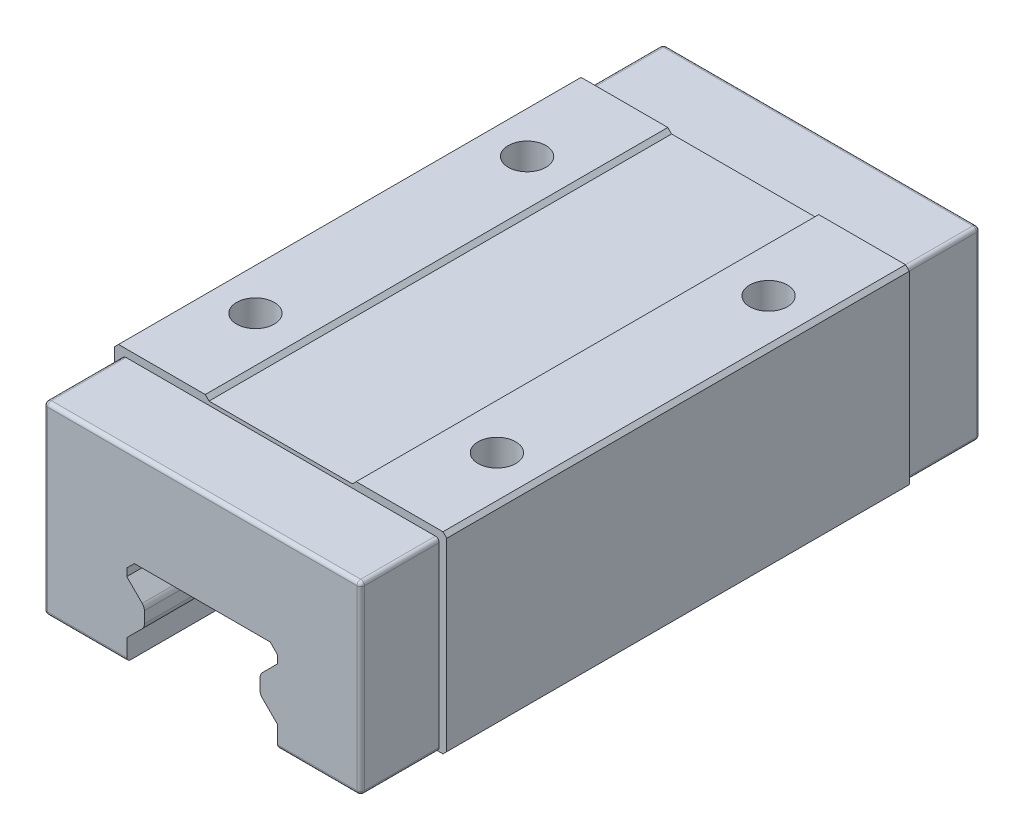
SolidWorks part; units mm, degrees
ref_plane "Front Plane" through (0, 0, 0) normal (0, 0, 1) x (1, 0, 0)
ref_plane "Top Plane" through (0, 0, 0) normal (0, 1, 0) x (1, 0, 0)
ref_plane "Right Plane" through (0, 0, 0) normal (1, 0, 0) x (0, 0, -1)
sketch "Sketch1" plane through (0, 0, 0) normal (0, 0, 1) x (1, 0, 0)
  line L1 (-22, 4.5) -> (22, 4.5)
  line L2 (-22, 4.5) -> (-22, 30)
  line L3 (-22, 30) -> (22, 30)
  line L4 (22, 4.5) -> (22, 30)
  line L5 (-22, 4.5) -> (22, 30) construction
  line L6 (-22, 30) -> (22, 4.5) construction
  point P0 (0, 17.25)
  dimension "D1" = 30
  dimension "D2" = 4.5
  dimension "D3" = 44
extrude "Boss-Extrude1" add sketch "Sketch1" along normal mid plane 61.3
sketch "Sketch2" plane through (0, 0, 0) normal (0, 0, 1) x (1, 0, 0)
  line L0 (-22, 4.5) -> (22, 4.5) construction
  line L1 (-21, 4.5) -> (21, 4.5)
  line L2 (-21, 4.5) -> (-21, 29)
  line L3 (-21, 29) -> (21, 29)
  line L4 (21, 4.5) -> (21, 29)
  line L5 (-21, 29) -> (-22, 29) construction
  line L6 (-22, 30) -> (-22, 4.5) construction
  line L7 (21, 29) -> (21, 30) construction
  line L8 (22, 30) -> (-22, 30) construction
  line L9 (21, 29) -> (22, 29) construction
  line L10 (22, 4.5) -> (22, 30) construction
  point P9 (0, 29)
  dimension "D1" = 1
extrude "Boss-Extrude2" add sketch "Sketch2" along normal mid plane 82.1
sketch "Sketch3" plane through (0, 0, 41.05) normal (0, 0, 1) x (1, 0, 0)
  line L1 (-10, 16.3) -> (10, 16.3)
  line L2 (-10, 16.3) -> (-10, 0)
  line L3 (-10, 0) -> (10, 0)
  line L4 (10, 16.3) -> (10, 0)
  line L5 (-10, 16.3) -> (10, 0) construction
  line L6 (-10, 0) -> (10, 16.3) construction
  point P0 (0, 8.15)
  dimension "D1" = 20
  dimension "D2" = 16.3
extrude "Cut-Extrude1" cut sketch "Sketch3" against normal through all
sketch "Sketch4" plane through (0, 0, 41.05) normal (0, 0, 1) x (1, 0, 0)
  line L0 (-10, 14.3) -> (-10, 7.3)
  line L1 (-10, 16.3) -> (-10, 4.5) construction
  line L2 (-10, 7.3) -> (-7.6667, 9.6333)
  line L3 (-7.6667, 9.6333) -> (-7.6667, 11.9667)
  line L4 (-7.6667, 11.9667) -> (-10, 14.3)
  line L5 (10, 16.3) -> (-10, 16.3) construction
  line L6 (-7.6667, 11.9667) -> (-10, 11.9667) construction
  line L7 (-7.6667, 9.6333) -> (-10, 9.6333) construction
  line L8 (-8.8333, 11.9667) -> (-8.8333, 9.6333) construction
  line L9 (0, 0) -> (0, 16.3) construction
  line L10 (8.8333, 11.9667) -> (8.8333, 9.6333) construction
  line L11 (7.6667, 9.6333) -> (10, 9.6333) construction
  line L12 (7.6667, 11.9667) -> (10, 11.9667) construction
  line L13 (7.6667, 11.9667) -> (10, 14.3)
  line L14 (7.6667, 9.6333) -> (7.6667, 11.9667)
  line L15 (10, 7.3) -> (7.6667, 9.6333)
  line L16 (10, 14.3) -> (10, 7.3)
extrude "Boss-Extrude3" add sketch "Sketch4" against normal up to surface (82.1 mm away)
chamfer "Chamfer1" distance 1 angle 45 2 edges at (10, 16.3, 0) (-10, 16.3, 0)
fillet "Fillet1" radius 1 4 edges at (7.6667, 9.6333, 0) (7.6667, 11.9667, 0) (-7.6667, 9.6333, 0) (-7.6667, 11.9667, 0)
sketch "Sketch5" plane through (0, 0, 30.65) normal (0, 0, 1) x (1, 0, 0)
  line L0 (22, 30) -> (-22, 30) construction
  line L1 (-10, 30) -> (10, 30)
  line L2 (-10, 30) -> (-10, 29.5)
  line L3 (-10, 29.5) -> (10, 29.5)
  line L4 (10, 30) -> (10, 29.5)
  point P6 (0, 29.5)
  dimension "D1" = 20
  dimension "D2" = 0.5
extrude "Cut-Extrude2" cut sketch "Sketch5" against normal through all
chamfer "Chamfer2" distance 0.5 angle 45 6 edges at (22, 30, 0) (22, 4.5, 0) (-22, 4.5, 0) (-22, 30, 0) (10, 29.5, 0) (-10, 29.5, 0)
fillet "Fillet2" radius 0.5 18 edges at (-21, 4.5, -35.85) (15.5, 4.5, -41.05) (-21, 4.5, 35.85) (-15.5, 4.5, -41.05) (-15.5, 4.5, 41.05) (15.5, 4.5, 41.05) (21, 4.5, 35.85) (-21, 16.75, 41.05) (-21, 16.75, -41.05) (-21, 29, 35.85) (21, 29, 35.85) (21, 16.75, 41.05) (21, 16.75, -41.05) (0, 29, 41.05) (0, 29, -41.05) (21, 4.5, -35.85) (21, 29, -35.85) (-21, 29, -35.85)
sketch "Sketch6" plane through (0, 30, 0) normal (0, 1, 0) x (1, 0, 0)
  line L0 (-16, 18) -> (0, 0) construction
  line L1 (0, 0) -> (16, -18) construction
  line L2 (16, 18) -> (0, 0) construction
  line L3 (0, 0) -> (-16, -18) construction
  circle A0 centre (-16, 18) radius 2.5
  circle A1 centre (-16, -18) radius 2.5
  circle A2 centre (16, -18) radius 2.5
  circle A3 centre (16, 18) radius 2.5
  dimension "D1" = 5
  dimension "D2" = 32
  dimension "D3" = 36
extrude "Cut-Extrude3" cut sketch "Sketch6" against normal blind 7.5
sketch "Sketch7" plane through (0, 0, 0) normal (0, 0, 1) x (1, 0, 0)
  line L0 (-21.5, 30) -> (-31.5, 30)
  line L1 (-31.5, 30) -> (-31.5, 21)
  line L2 (-21.5, 30) -> (-21.5, 12)
  line L3 (-22, 29.5) -> (-22, 5) construction
  line L4 (-22, 12) -> (-21.5, 12)
  line L5 (-31.5, 21) -> (-31, 21)
  line L6 (0, 0) -> (0, 29.5) construction
  line L7 (-9.5, 29.5) -> (9.5, 29.5) construction
  line L8 (31.5, 21) -> (31, 21)
  line L9 (22, 12) -> (21.5, 12)
  line L10 (21.5, 30) -> (21.5, 12)
  line L11 (31.5, 30) -> (31.5, 21)
  line L12 (21.5, 30) -> (31.5, 30)
  arc A1 (-31, 21) -> (-22, 12) centre (-31, 12) cw
  arc A2 (31, 21) -> (22, 12) centre (31, 12) ccw
  point P22 (-31.25, 21)
  dimension "D1" = 63
  dimension "D2" = 9
  dimension "D3" = 0.5
extrude "Boss-Extrude4" [suppressed] add sketch "Sketch7" along normal mid plane 30
sketch "Sketch8" [suppressed] plane through (0, 0, 0) normal (0, 0, 1) x (1, 0, 0)
  line L5 (-35, 30) -> (-35, 40)
  line L6 (-35, 30) -> (-23.38, 30)
  line L7 (-35, 40) -> (-23.38, 40)
  line L8 (-23.38, 30) -> (-23.38, 40)
  line L9 (35, 30) -> (35, 40)
  line L10 (35, 30) -> (23.38, 30)
  line L11 (35, 40) -> (23.38, 40)
  line L13 (23.38, 40) -> (23.38, 30)
extrude "Boss-Extrude5" [suppressed] add sketch "Sketch8" along normal mid plane 61.3
chamfer "Chamfer3" [suppressed] distance 0.5 angle 45
fillet "Fillet3" [suppressed] radius 5
equation "\"D2@Sketch4\"=\"D1@Sketch4\"*3.5"
